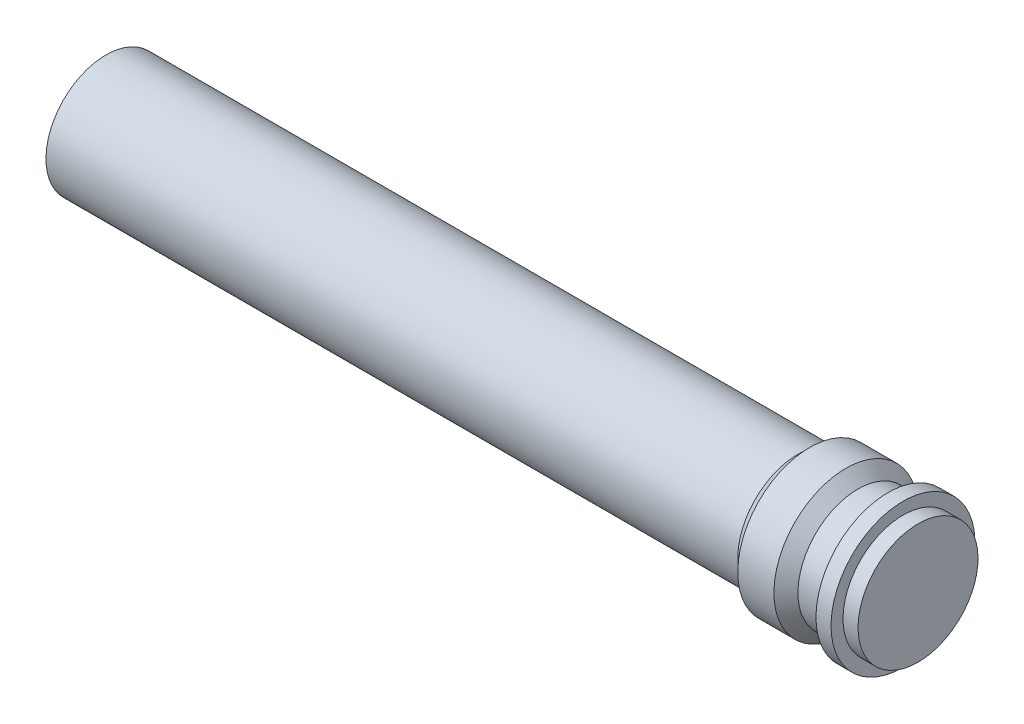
SolidWorks part; units mm, degrees
ref_plane "Front Plane" through (0, 0, 0) normal (0, 0, 1) x (1, 0, 0)
ref_plane "Top Plane" through (0, 0, 0) normal (0, 1, 0) x (1, 0, 0)
ref_plane "Right Plane" through (0, 0, 0) normal (1, 0, 0) x (0, 0, -1)
sketch "Sketch1" plane through (0, 0, 0) normal (0, 0, 1) x (1, 0, 0)
  line L0 (0, 0) -> (0, 3.25)
  line L1 (0, 3.25) -> (37.4815, 3.25)
  line L2 (37.4815, 3.25) -> (38.1315, 3.9)
  line L3 (38.1315, 3.9) -> (40.0907, 3.9)
  line L4 (40.0907, 3.9) -> (40.7407, 3.25)
  line L5 (40.7407, 3.25) -> (42.3704, 3.25)
  line L6 (42.3704, 3.25) -> (42.3704, 3.9)
  line L7 (42.3704, 3.9) -> (43.1852, 3.9)
  line L8 (43.1852, 3.9) -> (43.1852, 3.25)
  line L9 (43.1852, 3.25) -> (44, 3.25)
  line L10 (44, 3.25) -> (44, 0)
  line L11 (44, 0) -> (0, 0)
  line L12 (44, 0) -> (0, 0) construction
  dimension "D1" = 44
  dimension "D2" = 3.25
  dimension "D3" = 3.9
  dimension "D4" = 0.8148
  dimension "D5" = 0.8148
  dimension "D6" = 45
  dimension "D7" = 1.9593
  dimension "D8" = 3.9093
revolve "Revolve1" add sketch "Sketch1" angle 360 about L12
